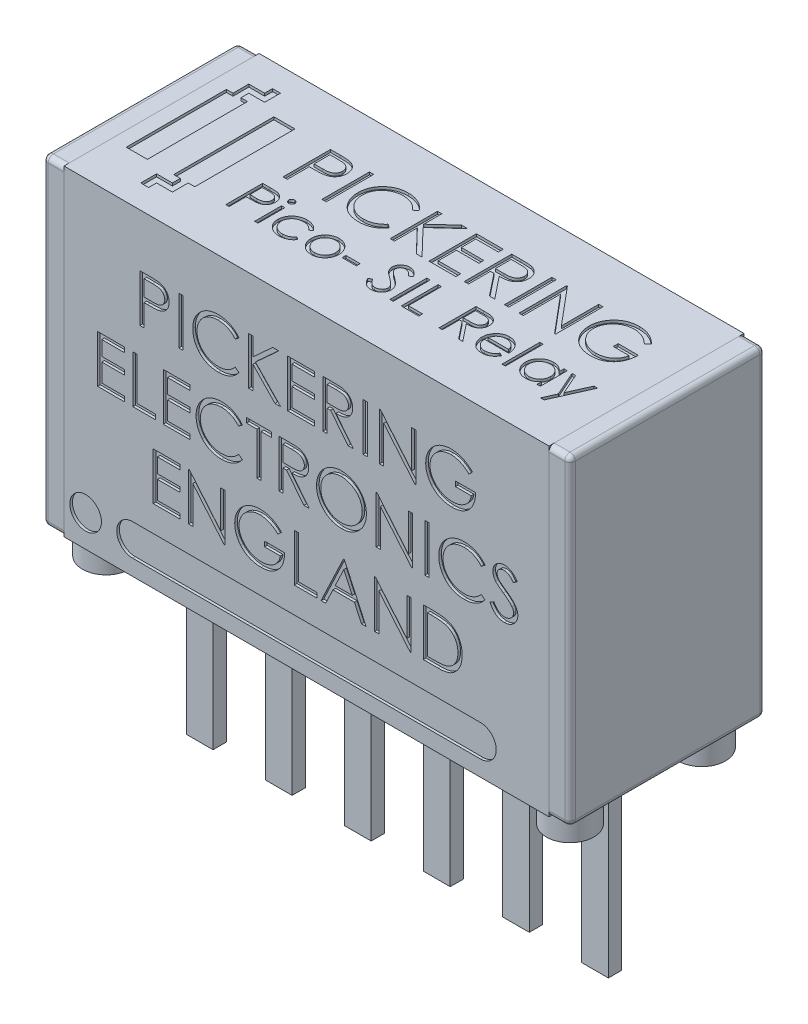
SolidWorks part; units mm, degrees
ref_plane "Front Plane" through (0, 0, 0) normal (0, 0, 1) x (1, 0, 0)
ref_plane "Top Plane" through (0, 0, 0) normal (0, 1, 0) x (1, 0, 0)
ref_plane "Right Plane" through (0, 0, 0) normal (1, 0, 0) x (0, 0, -1)
sketch "Sketch1" plane through (0, 0, 0) normal (0, 1, 0) x (1, 0, 0)
  line L1 (4.6, -1.85) -> (-4.6, -1.85)
  line L2 (4.6, -1.85) -> (4.6, 1.85)
  line L3 (4.6, 1.85) -> (-4.6, 1.85)
  line L4 (-4.6, -1.85) -> (-4.6, 1.85)
  line L5 (4.6, -1.85) -> (-4.6, 1.85) construction
  line L6 (4.6, 1.85) -> (-4.6, -1.85) construction
  point P0 (0, 0)
  dimension "D1" = 3.7
  dimension "D2" = 9.2
extrude "Main Body" add sketch "Sketch1" along normal blind 6.092
sketch "Sketch2" plane through (4.6, 0, 0) normal (1, 0, 0) x (0, 0, -1)
  line L1 (-1.85, 6.092) -> (1.85, 6.092)
  line L2 (-1.85, 6.092) -> (-1.85, 0)
  line L3 (-1.85, 0) -> (1.85, 0)
  line L4 (1.85, 6.092) -> (1.85, 0)
extrude "Right Side" add sketch "Sketch2" along normal blind 0.4 separate body
sketch "Sketch3" plane through (-4.6, 0, 0) normal (-1, 0, 0) x (0, 0, 1)
  line L1 (-1.85, 6.092) -> (1.85, 6.092)
  line L2 (-1.85, 6.092) -> (-1.85, 0)
  line L3 (-1.85, 0) -> (1.85, 0)
  line L4 (1.85, 6.092) -> (1.85, 0)
extrude "Left Side" add sketch "Sketch3" along normal blind 0.4 separate body
sketch "Sketch4" plane through (0, 0, 0) normal (0, -1, 0) x (1, 0, 0)
  line L1 (4.6, -1.85) -> (-4.6, -1.85) construction
  line L4 (5, 1.85) -> (5, -1.85) construction
  line L5 (-4.6, 1.85) -> (4.6, 1.85) construction
  line L6 (-5, -1.85) -> (-5, 1.85) construction
  circle A0 centre (4.4, -1.25) radius 0.45
  circle A1 centre (4.4, 1.25) radius 0.45
  circle A2 centre (-4.4, 1.25) radius 0.45
  circle A3 centre (-4.4, -1.25) radius 0.45
  dimension "D1" = 0.9
  dimension "D4" = 0.9
  dimension "D7" = 0.9
  dimension "D10" = 0.9
  dimension "D2" = 0.6
  dimension "D3" = 0.6
  dimension "D5" = 0.6
  dimension "D6" = 0.6
  dimension "D8" = 0.6
  dimension "D9" = 0.6
  dimension "D11" = 0.6
  dimension "D12" = 0.6
extrude "Feet" add sketch "Sketch4" along normal blind 0.508 separate body
sketch "Sketch5" plane through (0, 0, 0) normal (0, -1, 0) x (1, 0, 0)
  line L1 (-4.004, -0.127) -> (-3.496, -0.127)
  line L2 (-4.004, -0.127) -> (-4.004, 0.127)
  line L3 (-4.004, 0.127) -> (-3.496, 0.127)
  line L4 (-3.496, -0.127) -> (-3.496, 0.127)
  line L5 (-4.004, -0.127) -> (-3.496, 0.127) construction
  line L6 (-4.004, 0.127) -> (-3.496, -0.127) construction
  line L7 (-0.496, -0.127) -> (-1.004, -0.127)
  line L8 (-0.496, -0.127) -> (-0.496, 0.127)
  line L9 (-0.496, 0.127) -> (-1.004, 0.127)
  line L10 (-1.004, -0.127) -> (-1.004, 0.127)
  line L11 (-0.496, -0.127) -> (-1.004, 0.127) construction
  line L12 (-0.496, 0.127) -> (-1.004, -0.127) construction
  line L13 (1.004, -0.127) -> (0.496, -0.127)
  line L14 (1.004, -0.127) -> (1.004, 0.127)
  line L15 (1.004, 0.127) -> (0.496, 0.127)
  line L16 (0.496, -0.127) -> (0.496, 0.127)
  line L17 (1.004, -0.127) -> (0.496, 0.127) construction
  line L18 (1.004, 0.127) -> (0.496, -0.127) construction
  line L19 (3.496, -0.127) -> (4.004, -0.127)
  line L20 (3.496, -0.127) -> (3.496, 0.127)
  line L21 (3.496, 0.127) -> (4.004, 0.127)
  line L22 (4.004, -0.127) -> (4.004, 0.127)
  line L23 (3.496, -0.127) -> (4.004, 0.127) construction
  line L24 (3.496, 0.127) -> (4.004, -0.127) construction
  line L27 (5, 1.85) -> (5, -1.85) construction
  line L28 (-1.996, -0.127) -> (-2.504, -0.127)
  line L29 (-1.996, -0.127) -> (-1.996, 0.127)
  line L30 (-1.996, 0.127) -> (-2.504, 0.127)
  line L31 (-2.504, -0.127) -> (-2.504, 0.127)
  line L32 (-1.996, -0.127) -> (-2.504, 0.127) construction
  line L33 (-1.996, 0.127) -> (-2.504, -0.127) construction
  line L34 (2.504, -0.127) -> (1.996, -0.127)
  line L35 (2.504, -0.127) -> (2.504, 0.127)
  line L36 (2.504, 0.127) -> (1.996, 0.127)
  line L37 (1.996, -0.127) -> (1.996, 0.127)
  line L38 (2.504, -0.127) -> (1.996, 0.127) construction
  line L39 (2.504, 0.127) -> (1.996, -0.127) construction
  point P0 (-3.75, 0)
  point P5 (-0.75, 0)
  point P10 (0.75, 0)
  point P15 (3.75, 0)
  point P23 (-2.25, 0)
  point P28 (2.25, 0)
  dimension "D1" = 0.254
  dimension "D2" = 0.508
  dimension "D3" = 0.254
  dimension "D4" = 0.508
  dimension "D5" = 0.254
  dimension "D6" = 0.508
  dimension "D7" = 0.254
  dimension "D8" = 0.508
  dimension "D9" = 1.5
  dimension "D10" = 1.5
  dimension "D11" = 1.5
  dimension "D12" = 1.5
  dimension "D13" = 0.508
  dimension "D14" = 0.254
  dimension "D15" = 0.508
  dimension "D16" = 0.254
  dimension "D17" = 1.5
  dimension "D18" = 1.25
extrude "Pins" add sketch "Sketch5" along normal blind 3.808
sketch "Sketch6"
  dimension "D1" = 0.45
  dimension "D2" = 1.8
  dimension "D3" = 0.9
sketch_block_instance "Logo-1"
sketch_block "Logo" parameters "D1"=0.4, "D2"=0.4, "D3"=1.9, "D4"=1.9, "D5"=1.3, "D6"=0.3, "D7"=0.15, "D8"=0.15, "D9"=0.15, "D10"=0.15, "D11"=0.3, "D12"=0.125, "D13"=0.15, "D14"=0.125, "D15"=0.3, "D16"=0.15, "D17"=0.3, "D18"=0.15, "D19"=0.15
extrude "Top Writing" cut sketch "Sketch6" against normal blind 0.05
sketch "Sketch7"
  dimension "D9" = 0.6
  dimension "D1" = 8.6
  dimension "D2" = 0.3
  dimension "D3" = 1.9
  dimension "D4" = 1.4
  dimension "D5" = 1.4
  dimension "D6" = 0.6
  dimension "D7" = 5
  dimension "D8" = 1.7
  dimension "D10" = 0.6
  dimension "D11" = 0.6
extrude "Front writing" cut sketch "Sketch7" against normal blind 0.05
sketch "Sketch8" plane through (0, 0, -1.85) normal (0, 0, -1) x (-1, 0, 0)
  line L0 (3.3, 0.6) -> (-3.3, 0.6) construction
  line L1 (3.3, 0.279) -> (-3.3, 0.279)
  line L2 (3.3, 0.921) -> (-3.3, 0.921)
  line L3 (5, 6.092) -> (5, 0) construction
  line L4 (-4.6, 0) -> (4.6, 0) construction
  arc A0 (3.3, 0.279) -> (3.3, 0.921) centre (3.3, 0.6) ccw
  arc A1 (-3.3, 0.921) -> (-3.3, 0.279) centre (-3.3, 0.6) ccw
  point P2 (0, 0.6)
  dimension "D1" = 1.7
  dimension "D2" = 0.6
extrude "Extrude8" cut sketch "Sketch8" against normal blind 0.05
sketch "Sketch9"
  dimension "D1" = 2.7
  dimension "D2" = 7
  dimension "D3" = 1.5
extrude "Relay ID" add sketch "Sketch9" along normal blind 0.0001
fillet "Fillet1" radius 0.1 8 edges at (-4.8, 0, 1.85) (-4.8, 0, -1.85) (-5, 0, 0) (-5, 3.046, 1.85) (-4.8, 6.092, 1.85) (-5, 6.092, 0) (-5, 3.046, -1.85) (-4.8, 6.092, -1.85)
fillet "Fillet2" radius 0.1 8 edges at (5, 6.092, 0) (5, 3.046, -1.85) (5, 0, 0) (5, 3.046, 1.85) (4.8, 0, -1.85) (4.8, 6.092, -1.85) (4.8, 6.092, 1.85) (4.8, 0, 1.85)
